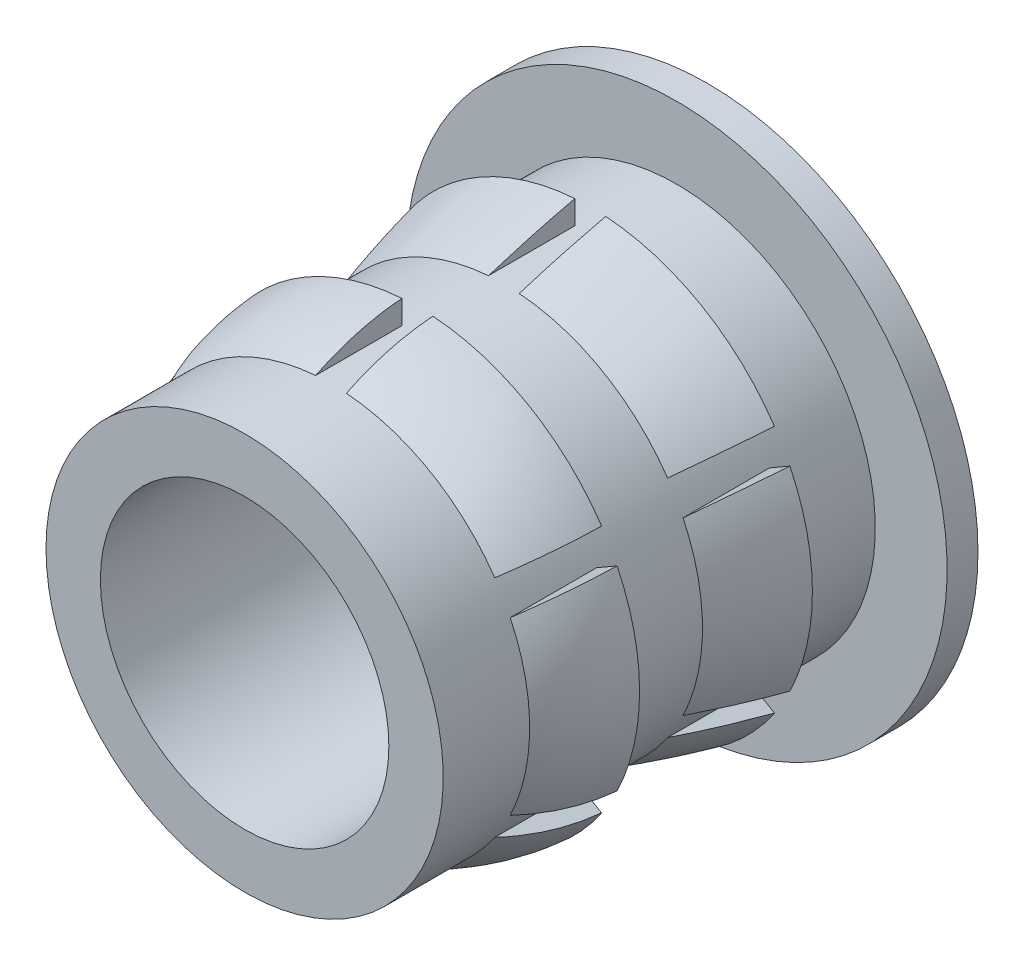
SolidWorks part; units mm, degrees
other "<flanged insert 7(16)-20>-"
ref_plane "Front Plane" through (0, 0, 0) normal (0, 0, 1) x (1, 0, 0)
ref_plane "Top Plane" through (0, 0, 0) normal (0, 1, 0) x (1, 0, 0)
ref_plane "Right Plane" through (0, 0, 0) normal (1, 0, 0) x (0, 0, -1)
inserted part "flanged insert 7(16)-20"
